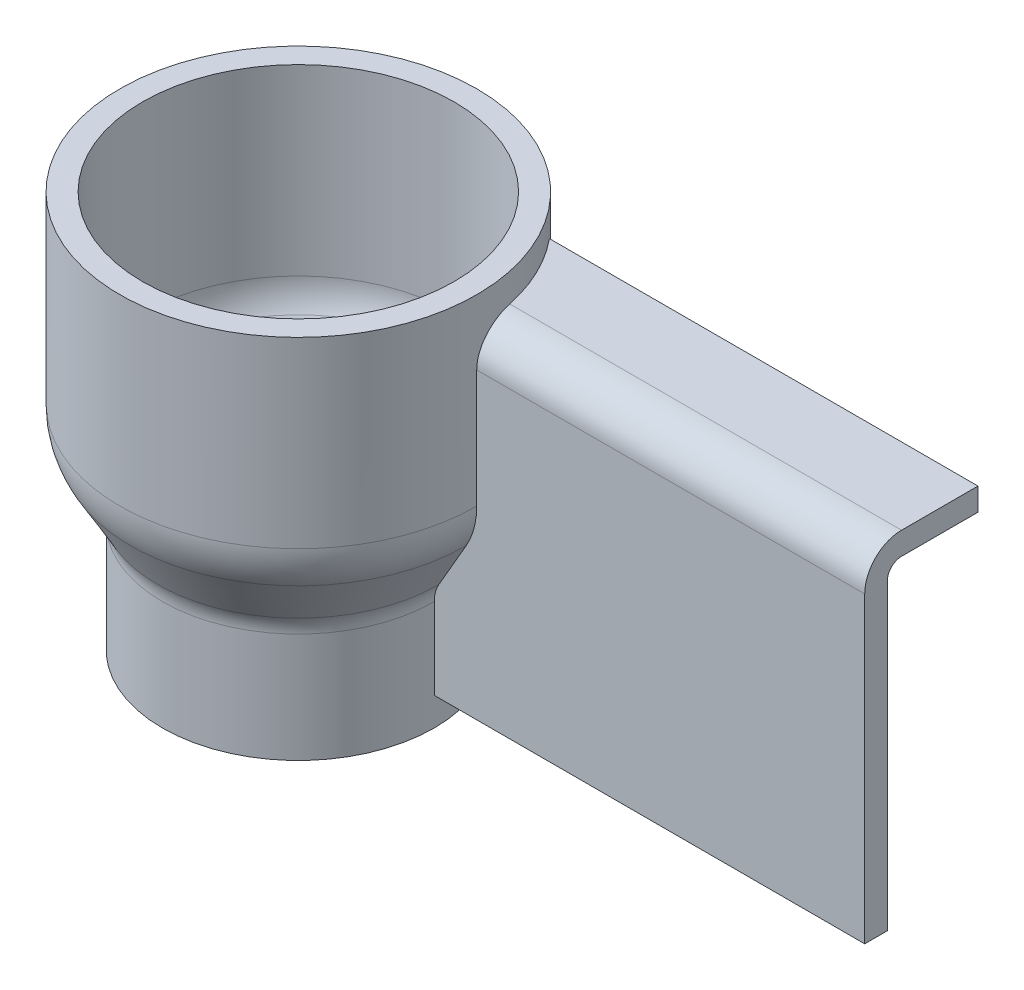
SolidWorks part; units mm, degrees
ref_plane "Front Plane" through (0, 0, 0) normal (0, 0, 1) x (1, 0, 0)
ref_plane "Top Plane" through (0, 0, 0) normal (0, 1, 0) x (1, 0, 0)
ref_plane "Right Plane" through (0, 0, 0) normal (1, 0, 0) x (0, 0, -1)
sketch "strainer" plane through (0, 0, 0) normal (0, 0, 1) x (1, 0, 0)
  line L0 (0, 0) -> (0, 47.8971) construction
  line L2 (-34.925, 0) -> (-34.925, -41.047)
  line L3 (-33.2235, -47.397) -> (-27.1015, -58.0007)
  line L4 (-25.4, -64.3507) -> (-25.4, -88.9)
  arc A0 (-25.4, -64.3507) -> (-27.1015, -58.0007) centre (-38.1, -64.3507) ccw
  arc A1 (-33.2235, -47.397) -> (-34.925, -41.047) centre (-22.225, -41.047) cw
  point P9 (-25.4, -60.9478)
  dimension "D6" = 12.7
  dimension "D1" = 69.85
  dimension "D2" = 27.9522
  dimension "D3" = 88.9
  dimension "D4" = 50.8
  dimension "D5" = 30
ref_plane "bracket.start" through (127, 0, 0) normal (1, 0, 0) x (0, 0, -1)
sketch "bracket" plane through (127, 0, 0) normal (1, 0, 0) x (0, 0, -1)
  line L0 (0, -6.35) -> (0, -82.55)
  line L1 (0, -6.35) -> (25.4, -6.35)
  dimension "D1" = 6.35
  dimension "D2" = 25.4
  dimension "D3" = 76.2
revolve "Revolve-Thin1" add sketch "strainer" angle 360 about L0
extrude "Extrude-Thin1" add sketch "bracket" against normal up to next thin
